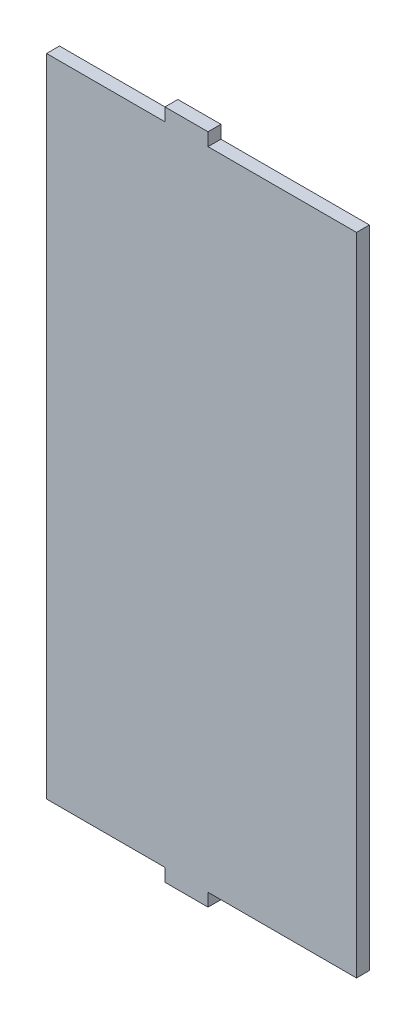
SolidWorks part; units mm, degrees
ref_plane "Front Plane" through (0, 0, 0) normal (0, 0, 1) x (1, 0, 0)
ref_plane "Top Plane" through (0, 0, 0) normal (0, 1, 0) x (1, 0, 0)
ref_plane "Right Plane" through (0, 0, 0) normal (1, 0, 0) x (0, 0, -1)
sketch "Croquis1" plane through (0, 0, 0) normal (0, 0, 1) x (1, 0, 0)
  line L0 (-12.5, -375) -> (-12.5, -390)
  line L5 (-150, 375) -> (-12.5, 375)
  line L6 (-150, 375) -> (-150, -375)
  line L7 (-150, -375) -> (-12.5, -375)
  line L8 (210, 375) -> (210, -375)
  line L9 (-12.5, -390) -> (37.5, -390)
  line L10 (37.5, -390) -> (37.5, -375)
  line L11 (0, 0) -> (-606.7298, 0) construction
  line L12 (37.5, 390) -> (37.5, 375)
  line L13 (-12.5, 390) -> (37.5, 390)
  line L14 (-12.5, 375) -> (-12.5, 390)
  line L15 (37.5, 375) -> (210, 375)
  line L16 (37.5, -375) -> (210, -375)
  dimension "D1" = 360
  dimension "D2" = 150
  dimension "D3" = 750
  dimension "D5" = 50
  dimension "D6" = 15
  dimension "D7" = 137.5
extrude "Saliente-Extruir1" add sketch "Croquis1" along normal blind 15
